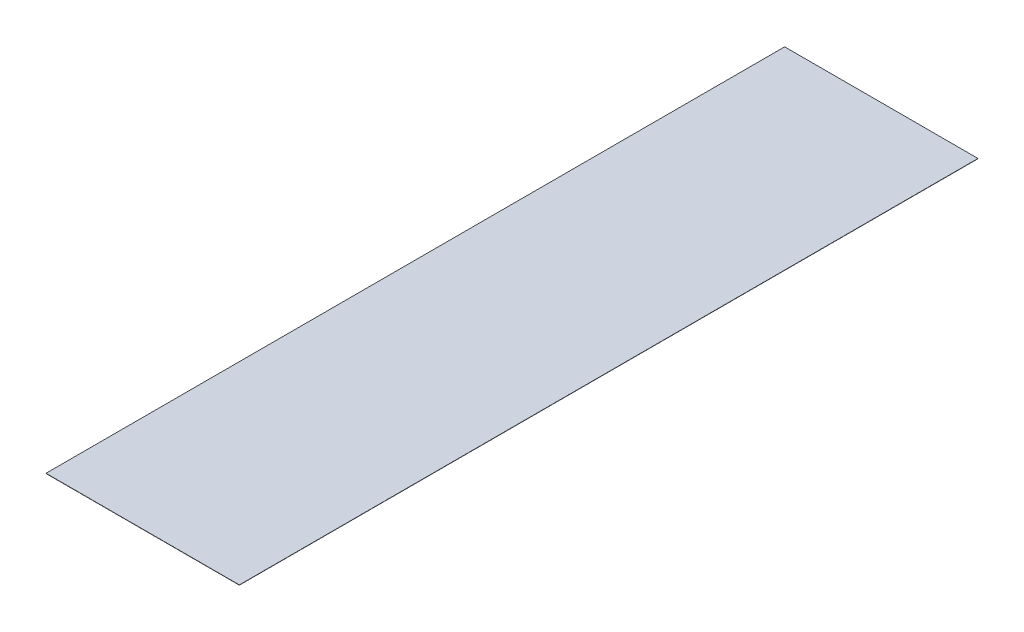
SolidWorks part; units mm, degrees
ref_plane "Front Plane" through (0, 0, 0) normal (0, 0, 1) x (1, 0, 0)
ref_plane "Top Plane" through (0, 0, 0) normal (0, 1, 0) x (1, 0, 0)
ref_plane "Right Plane" through (0, 0, 0) normal (1, 0, 0) x (0, 0, -1)
sketch "Sketch1" plane through (0, 0, 0) normal (0, 1, 0) x (1, 0, 0)
  line L0 (-3.3035, -12.1285) -> (3.0465, -12.1285)
  line L1 (-3.3035, 12.1285) -> (3.0465, 12.1285)
  line L2 (-3.3035, -12.1285) -> (-3.3035, 12.1285)
  line L3 (3.0465, -12.1285) -> (3.0465, 12.1285)
  line L4 (3.0465, -12.1285) -> (-3.3035, -12.1285)
extrude "Extrude1" add sketch "Sketch1" along normal blind 0.0079 contours L0 L3 L1 L2
